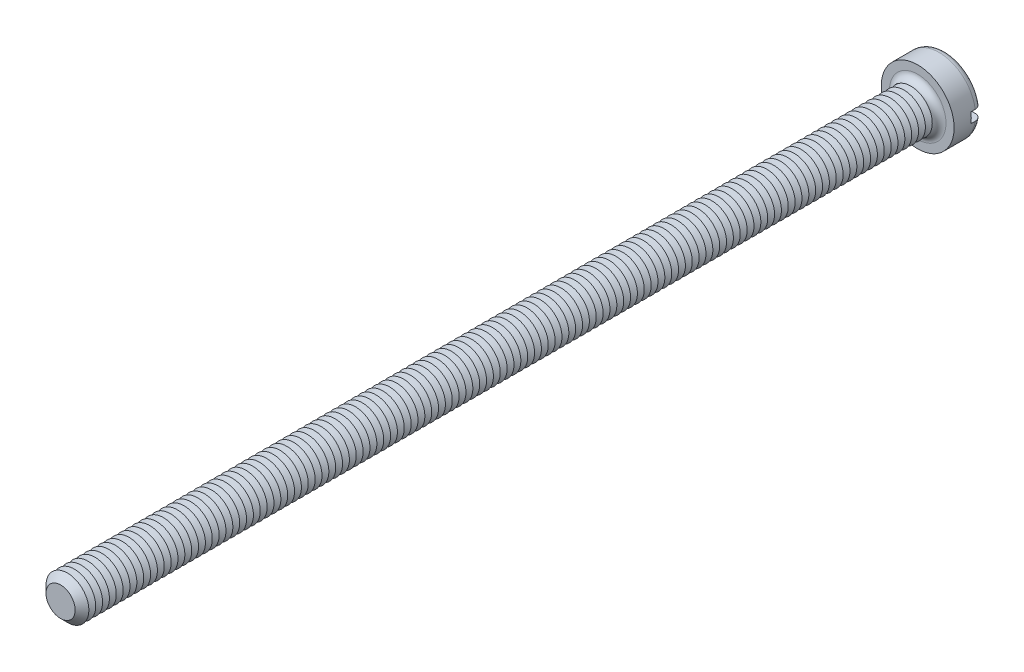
SolidWorks part; units mm, degrees
ref_plane "Front Plane" through (0, 0, 0) normal (0, 0, 1) x (1, 0, 0)
ref_plane "Top Plane" through (0, 0, 0) normal (0, 1, 0) x (1, 0, 0)
ref_plane "Right Plane" through (0, 0, 0) normal (1, 0, 0) x (0, 0, -1)
sketch "Sketch3" plane through (0, 0, 0) normal (0, 0, 1) x (1, 0, 0)
  circle A0 centre (0, 0) radius 4.25
  dimension "D1" = 8.5
extrude "Boss-Extrude2" add sketch "Sketch3" against normal blind 3.3
sketch "Sketch4" plane through (0, 0, 0) normal (0, 0, 1) x (1, 0, 0)
  circle A0 centre (0, 0) radius 2.5
  dimension "D1" = 5
extrude "Boss-Extrude3" add sketch "Sketch4" along normal blind 100
fillet "Fillet1" radius 0.8 2 edges at (4.25, 0, -3.3) (2.5, 0, 0)
chamfer "Chamfer1" distance 0.8 angle 45 1 edges at (2.5, 0, 100)
sketch "Sketch5" plane through (0, 0, 0) normal (1, 0, 0) x (0, 0, -1)
  line L0 (1.6944, 0) -> (-7.6738, 0) construction
sketch "Sketch6" plane through (0, 0, 0) normal (1, 0, 0) x (0, 0, -1)
  line L0 (-0.8, 2.5) -> (-1.2, 1.8072)
  line L1 (-1.2, 1.8072) -> (-1.6, 2.5)
  line L2 (-0.8, 2.5) -> (-99.2, 2.5) construction
  line L3 (-1.6, 2.5) -> (-0.8, 2.5)
  dimension "D1" = 0.8
revolve "Cut-Revolve1" cut sketch "Sketch6" angle 360 about L0
pattern_linear "LPattern1" count 123 spacing 0.8 along (0, 0, 1) of "Cut-Revolve1"
sketch "Sketch8" plane through (0, 0, -3.3) normal (0, 0, -1) x (-1, 0, 0)
  line L1 (4.25, -0.6) -> (-4.25, -0.6)
  line L2 (4.25, -0.6) -> (4.25, 0.6)
  line L3 (4.25, 0.6) -> (-4.25, 0.6)
  line L4 (-4.25, -0.6) -> (-4.25, 0.6)
  line L5 (4.25, -0.6) -> (-4.25, 0.6) construction
  line L6 (4.25, 0.6) -> (-4.25, -0.6) construction
  point P0 (0, 0)
  dimension "D1" = 8.5
  dimension "D2" = 1.2
extrude "Cut-Extrude1" cut sketch "Sketch8" against normal blind 1.3
